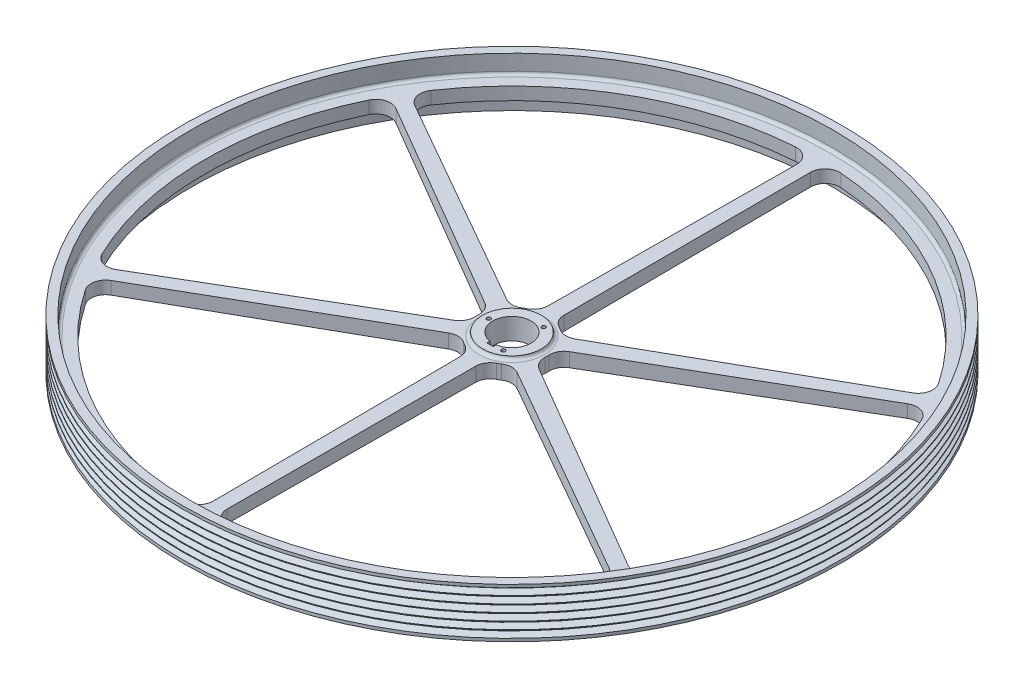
SolidWorks part; units mm, degrees
ref_plane "Front" through (0, 0, 0) normal (0, 0, 1) x (1, 0, 0)
ref_plane "Top" through (0, 0, 0) normal (0, 1, 0) x (1, 0, 0)
ref_plane "Right" through (0, 0, 0) normal (1, 0, 0) x (0, 0, -1)
sketch "Sketch1" plane through (0, 0, 0) normal (0, 0, 1) x (1, 0, 0)
  line L0 (0, 85) -> (0, -85)
  line L1 (1127, 0.095) -> (0, 0) construction
  line L2 (1088.0736, -21.4083) -> (111.4756, -23.9907)
  line L3 (0, -35.4916) -> (100.006, -35.4916)
  line L4 (1098.1, -85) -> (1098.1, -31.4066)
  line L27 (1127, -74.8) -> (1127, -85)
  line L28 (1127, 1.43) -> (1106, 8.6609)
  line L29 (1127, -1.24) -> (1106, -8.4709)
  line L30 (1127, -23.98) -> (1106, -16.7491)
  line L31 (1127, -26.65) -> (1106, -33.8809)
  line L32 (1127, -49.39) -> (1106, -42.1591)
  line L33 (1127, -52.06) -> (1106, -59.2909)
  line L34 (1127, -74.8) -> (1106, -67.5691)
  line L35 (1127, -52.06) -> (1127, -49.39)
  line L36 (1127, -26.65) -> (1127, -23.98)
  line L37 (1127, -1.24) -> (1127, 1.43)
  line L38 (1106, -42.1591) -> (1106, -33.8809)
  line L39 (1106, -67.5691) -> (1106, -59.2909)
  line L40 (1106, -16.7491) -> (1106, -8.4709)
  line L41 (1127, 74.8) -> (1106, 67.5691)
  line L42 (1127, 52.06) -> (1106, 59.2909)
  line L43 (1127, 49.39) -> (1106, 42.1591)
  line L44 (1127, 26.84) -> (1106, 33.8809)
  line L45 (1127, 24.17) -> (1106, 16.9391)
  line L46 (1127, 24.17) -> (1127, 26.84)
  line L47 (1127, 49.39) -> (1127, 52.06)
  line L48 (1127, 74.8) -> (1127, 85)
  line L49 (1106, 8.6609) -> (1106, 16.9391)
  line L50 (1106, 33.8809) -> (1106, 42.1591)
  line L51 (1106, 59.2909) -> (1106, 67.5691)
  line L55 (65.55, 35.5084) -> (63.075, -35.4916)
  line L63 (0, 155.8402) -> (0, -187.0083) construction
  line L65 (0, -85) -> (1127, -85)
  line L66 (0, 35.5084) -> (100, 35.5084)
  line L67 (0, 85) -> (1127, 85)
  line L148 (1088.0699, 21.5917) -> (111.4715, 24.0095)
  line L149 (1098.0947, 85) -> (1098.0947, 31.5917)
  arc A0 (100.006, -35.4916) -> (111.4756, -23.9907) centre (111.506, -35.4906) cw
  arc A1 (1088.0736, -21.4083) -> (1098.1, -31.4066) centre (1088.1, -31.4082) cw
  arc A43 (1088.0699, 21.5917) -> (1098.0947, 31.5917) centre (1088.0947, 31.5917) ccw
  arc A44 (100, 35.5084) -> (111.4715, 24.0095) centre (111.5, 35.5094) ccw
  dimension "D9" = 10
  dimension "D10" = 28.9
  dimension "D13" = 11.5
  dimension "D14" = 48
  dimension "D1" = 2254
  dimension "D2" = 170
  dimension "D3" = 21
  dimension "D4" = 71
  dimension "D5" = 10.2
  dimension "D6" = 2.67
  dimension "D7" = 38
  dimension "D8" = 22.74
  dimension "D11" = 200
  dimension "D12" = 43
  dimension "D15" = 131.1
  dimension "D16" = 126.15
revolve "Revolve1" add sketch "Sketch1" angle 360 about L63
sketch "Sketch3" plane through (0, 0, 0) normal (0, 1, 0) x (1, 0, 0)
  line L0 (0, 0) -> (0, 657.2252) construction
  line L1 (23.7258, 997.0642) -> (27.3527, 151.168)
  line L2 (117.0811, 99.351) -> (851.7283, 518.881)
  line L3 (0, 0) -> (731.9638, 0) construction
  line L4 (0, 0) -> (632.5097, 365.1797) construction
  arc A0 (868.28, 590.415) -> (77.4116, 1047.1425) centre (0, 0) ccw
  arc A1 (65.1431, 100.7788) -> (54.6016, 106.8582) centre (0, 0) ccw
  arc A2 (23.7258, 997.0642) -> (77.4116, 1047.1425) centre (73.7254, 997.2786) cw
  arc A3 (27.3527, 151.168) -> (54.6016, 106.8582) centre (77.3522, 151.3824) ccw
  arc A4 (117.0811, 99.351) -> (65.1431, 100.7788) centre (92.2861, 142.77) cw
  arc A5 (851.7283, 518.881) -> (868.28, 590.415) centre (826.9333, 562.3) ccw
  point P11 (23.5, 1049.737)
  point P14 (27.5, 116.8065)
  dimension "D1" = 2100
  dimension "D2" = 240
  dimension "D6" = 50
  dimension "D3" = 23.5
  dimension "D4" = 23.5
  dimension "D5" = 27.5
  dimension "D7" = 30
  dimension "D8" = 27.5
extrude "Cut-Extrude1" cut sketch "Sketch3" against normal through all and the other way through all
pattern_circular "CirPattern1" count 6 over 360 about axis through (0, 0, 0) along (0, 1, 0) of "Cut-Extrude1"
sketch "Sketch6" plane through (0, 0, 0) normal (0, 1, 0) x (1, 0, 0)
  line L0 (0, 0) -> (0, -132.8686) construction
  line L1 (-11, -48.1978) -> (-11, -75)
  line L2 (11, -48.1978) -> (11, -75)
  line L3 (-11, -75) -> (11, -75)
  point P9 (0, -75)
  dimension "D1" = 22
  dimension "D2" = 75
extrude "Cut-Extrude2" cut sketch "Sketch6" against normal through all and the other way through all flip side to cut
hole_wizard "5/8-11 Tapped Hole1" positions "Sketch8" profile "Sketch7" tap size "5/8-11" standard "Ansi Inch"
sketch "Sketch8" plane through (0, 35.5084, 0) normal (0, 1, 0) x (-1, 0, 0)
  circle A0 centre (0, 0) radius 79.3 construction
  point P0 (79.3, 0)
  dimension "D1" = 158.6
sketch "Sketch7" plane through (-79.3, 35.5084, 0) normal (1, 0, 0) x (0, 0, 1)
  line L0 (0, 0) -> (0, 39.0535)
  line L1 (0, 39.0535) -> (6.7462, 35)
  line L2 (6.7462, 35) -> (6.7462, 0)
  line L5 (6.7462, 0) -> (0, 0)
  line L10 (0, 39.0535) -> (-6.7462, 35) construction
  line L11 (0, -6.35) -> (0, 107.95) construction
  dimension "Tap Drill Dia." = 13.4925
  dimension "Tap Drill Depth" = 35
  dimension "Drill Angle" = 118
pattern_circular "CirPattern2" count 3 over 360 about axis through (0, 0, 0) along (0, 1, 0) of "5/8-11 Tapped Hole1"
scale "Scale1" scale about centroid uniform scaling yes scale factor 0.030511
